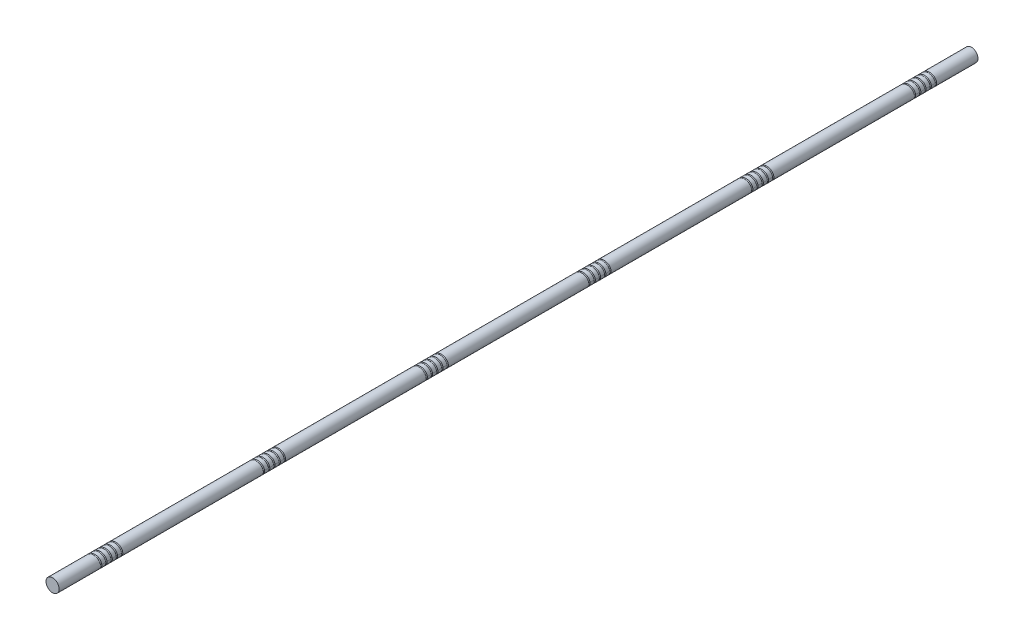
SolidWorks part; units mm, degrees
ref_plane "Front Plane" through (0, 0, 0) normal (0, 0, 1) x (1, 0, 0)
ref_plane "Top Plane" through (0, 0, 0) normal (0, 1, 0) x (1, 0, 0)
ref_plane "Right Plane" through (0, 0, 0) normal (1, 0, 0) x (0, 0, -1)
sketch "Sketch1" plane through (0, 0, 0) normal (0, 0, 1) x (1, 0, 0)
  circle A0 centre (0, 0) radius 25
  dimension "D1" = 50
extrude "Boss-Extrude1" add sketch "Sketch1" along normal blind 3500
ref_plane "Plane1" through (0, 0, 150) normal (0, 0, 1) x (1, 0, 0)
sketch "Sketch2" plane through (0, 0, 150) normal (0, 0, 1) x (1, 0, 0)
  circle A0 centre (0, 0) radius 27.1167
  dimension "D1" = 54.2333
curve "Helix/Spiral1"
sketch "Sketch3" plane through (0, 0, 0) normal (0, 1, 0) x (1, 0, 0)
  circle A0 centre (-27.1167, -150) radius 3.175
  spline S0 degree 3 number of poles 118 (-27.1167, -150) -> (-27.1167, -250) construction
  dimension "D1" = 6.35
sweep "Cut-Sweep1" cut profiles "Sketch3" path "Helix/Spiral1"
pattern_linear "LPattern1" count 6 spacing 620 along (0, 0, -1) of "Cut-Sweep1"
